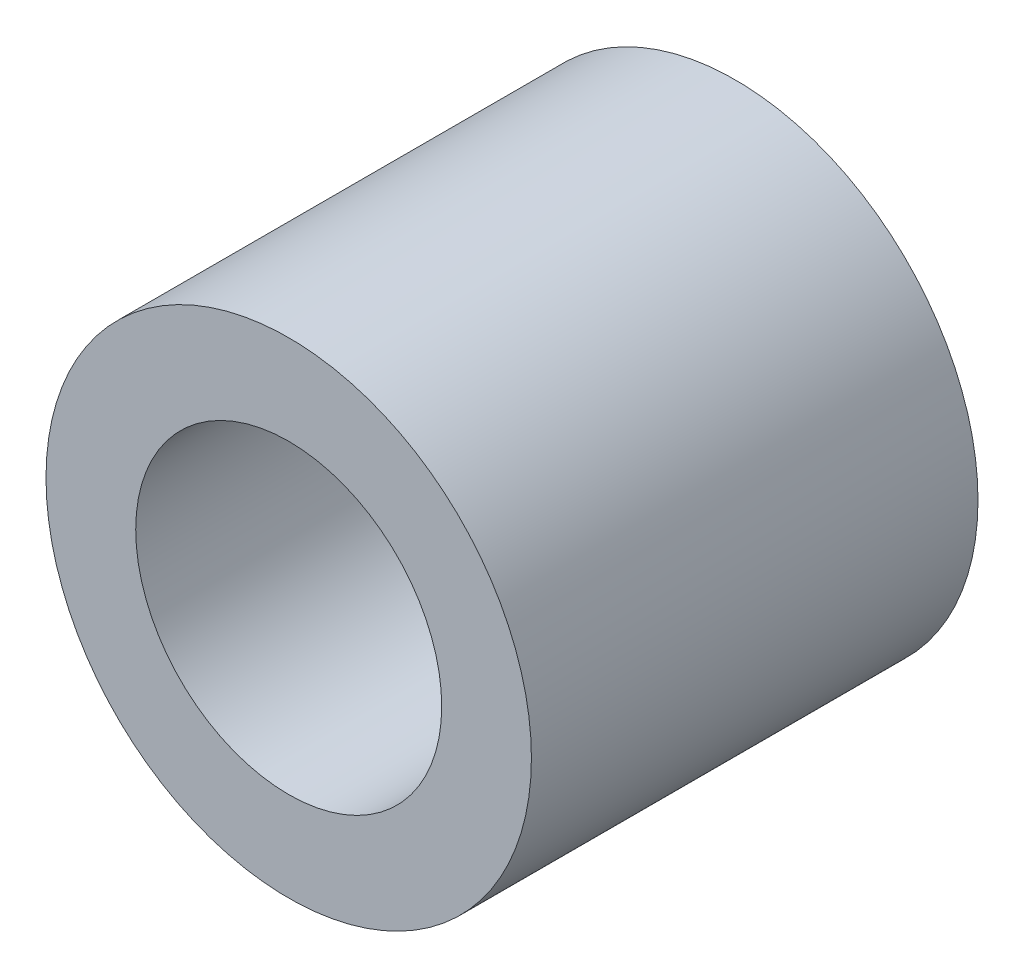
SolidWorks part; units mm, degrees
ref_plane "Front Plane" through (0, 0, 0) normal (0, 0, 1) x (1, 0, 0)
ref_plane "Top Plane" through (0, 0, 0) normal (0, 1, 0) x (1, 0, 0)
ref_plane "Right Plane" through (0, 0, 0) normal (1, 0, 0) x (0, 0, -1)
sketch "Sketch1" plane through (0, 0, 0) normal (0, 0, 1) x (1, 0, 0)
  circle A0 centre (0, 0) radius 5.0038
  circle A1 centre (0, 0) radius 7.9375
  dimension "D1" = 10.0076
  dimension "D2" = 15.875
extrude "Boss-Extrude1" add sketch "Sketch1" along normal blind 14.605
